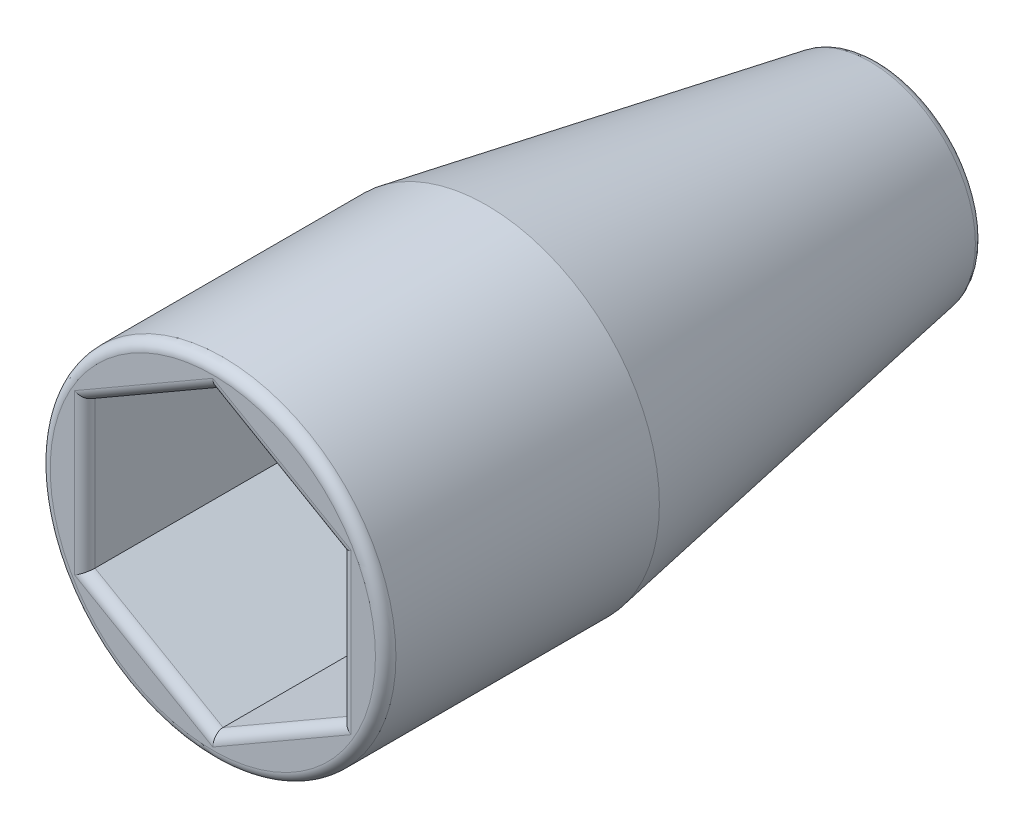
SolidWorks part; units mm, degrees
ref_plane "Plan de face" through (0, 0, 0) normal (0, 0, 1) x (1, 0, 0)
ref_plane "Plan de dessus" through (0, 0, 0) normal (0, 1, 0) x (1, 0, 0)
ref_plane "Plan de droite" through (0, 0, 0) normal (1, 0, 0) x (0, 0, -1)
sketch "Esquisse2" plane through (0, 0, 0) normal (0, 0, 1) x (1, 0, 0)
  circle A0 centre (0, 0) radius 6.75
  dimension "D1" = 13.5
extrude "Boss.-Extru.1" add sketch "Esquisse2" along normal blind 26
sketch "Esquisse3" plane through (0, 0, 26) normal (0, 0, 1) x (1, 0, 0)
  line L1 (5, -2.8868) -> (5, 2.8868)
  line L2 (5, 2.8868) -> (0, 5.7735)
  line L3 (0, 5.7735) -> (-5, 2.8868)
  line L4 (-5, 2.8868) -> (-5, -2.8868)
  line L5 (-5, -2.8868) -> (0, -5.7735)
  line L6 (0, -5.7735) -> (5, -2.8868)
  circle A0 centre (0, 0) radius 5 construction
  dimension "D1" = 10
extrude "Enlèv. mat.-Extru.1" cut sketch "Esquisse3" against normal blind 12
sketch "Esquisse4" plane through (0, 0, 0) normal (0, 0, -1) x (-1, 0, 0)
  circle A0 centre (0, 0) radius 3.2
  dimension "D1" = 6.4
extrude "Enlèv. mat.-Extru.2" cut sketch "Esquisse4" against normal blind 10
sketch "Esquisse5" plane through (0, 0, 10) normal (0, 0, -1) x (-1, 0, 0)
  circle A0 centre (0, 0) radius 1.75
  dimension "D1" = 3.5
extrude "Enlèv. mat.-Extru.3" cut sketch "Esquisse5" against normal up to next
sketch "Esquisse6" plane through (0, 0, 0) normal (0, 1, 0) x (1, 0, 0)
  line L0 (-4.05, 0) -> (-6.75, -15.3125)
  line L1 (6.75, 0) -> (-6.75, 0) construction
  line L2 (-6.75, -15.3125) -> (-6.75, 0)
  line L3 (-6.75, 0) -> (-4.05, 0)
  line L4 (-6.75, 0) -> (-6.75, -26) construction
  line L5 (0, 6.0052) -> (0, -33.1861) construction
  point P4 (-6.75, -15.596)
  dimension "D1" = 10
  dimension "D2" = 4.05
revolve "Enlèvement de matière-Révolution1" cut sketch "Esquisse6" angle 360 about L5
fillet "Congé2" radius 0.4 9 edges at (6.75, 0, 26) (5, 0, 26) (2.5, 4.3301, 26) (-2.5, 4.3301, 26) (-5, 0, 26) (-2.5, -4.3301, 26) (2.5, -4.3301, 26) (-4.05, 0, 0) (-3.2, 0, 0)
chamfer "Chanfrein2" distance 0.5 angle 30 2 edges at (-1.75, 0, 10) (1.75, 0, 14)
